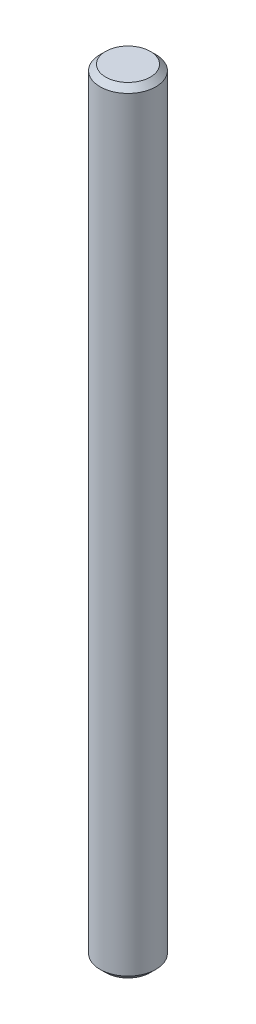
SolidWorks part; units mm, degrees
ref_plane "Front Plane" through (0, 0, 0) normal (0, 0, 1) x (1, 0, 0)
ref_plane "Top Plane" through (0, 0, 0) normal (0, 1, 0) x (1, 0, 0)
ref_plane "Right Plane" through (0, 0, 0) normal (1, 0, 0) x (0, 0, -1)
sketch "Sketch1" plane through (0, 0, 0) normal (0, 1, 0) x (1, 0, 0)
  circle A0 centre (0, 0) radius 5
  dimension "D1" = 10
extrude "Boss-Extrude1" add sketch "Sketch1" along normal mid plane 139
chamfer "Chamfer1" distance 1 angle 45 2 edges at (0, -69.5, 5) (0, 69.5, 5)
